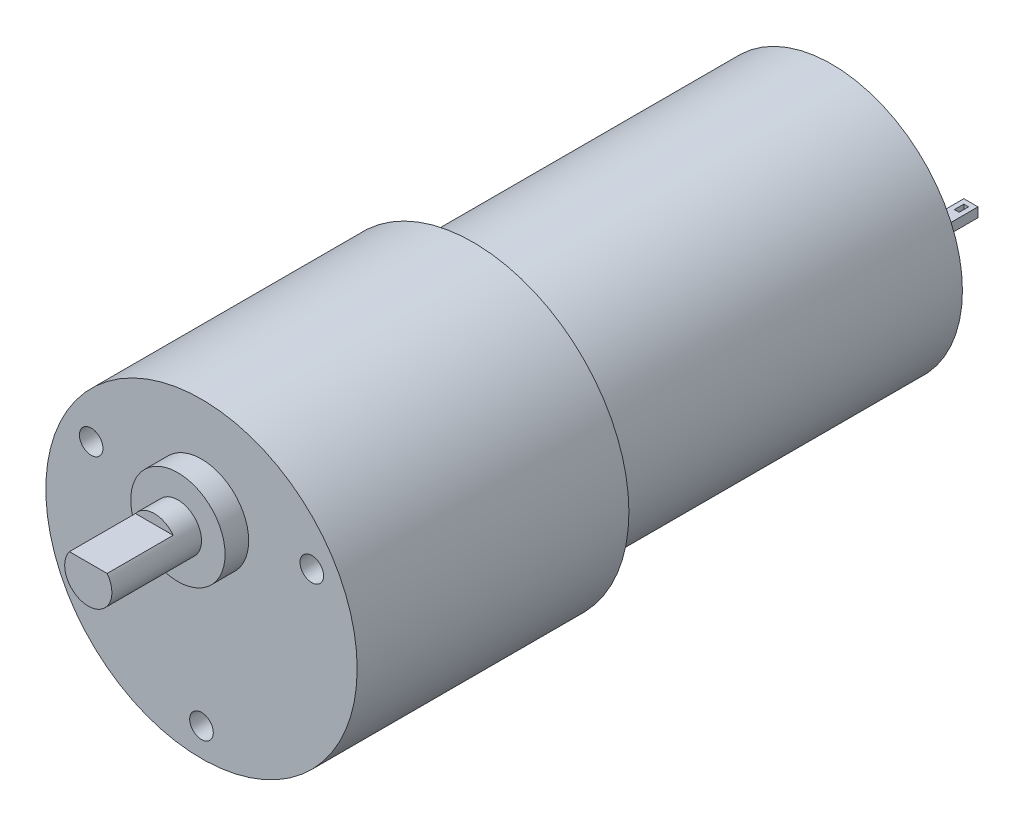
SolidWorks part; units mm, degrees
ref_plane "Plan de face" through (0, 0, 0) normal (0, 0, 1) x (1, 0, 0)
ref_plane "Plan de dessus" through (0, 0, 0) normal (0, 1, 0) x (1, 0, 0)
ref_plane "Plan de droite" through (0, 0, 0) normal (1, 0, 0) x (0, 0, -1)
sketch "Esquisse1" plane through (0, 0, 0) normal (0, 0, 1) x (1, 0, 0)
  circle A0 centre (0, 0) radius 13.85
  dimension "D1" = 27.7
extrude "Boss.-Extru.1" add sketch "Esquisse1" along normal blind 38
sketch "Esquisse2" plane through (0, 0, 0) normal (0, 0, -1) x (-1, 0, 0)
  circle A0 centre (0, 0) radius 5
  dimension "D1" = 10
extrude "Boss.-Extru.2" add sketch "Esquisse2" along normal blind 2.8
sketch "Esquisse3" plane through (0, 0, 0) normal (0, 1, 0) x (1, 0, 0)
  line L0 (13.85, 0) -> (-13.85, 0) construction
  line L1 (-7.5, 0) -> (-6, 0)
  line L2 (-7.5, 0) -> (-7.5, 8)
  line L3 (-7.5, 8) -> (-6, 8)
  line L4 (-6, 0) -> (-6, 8)
  line L5 (0, 0) -> (0, 2.8) construction
  line L6 (5, 2.8) -> (-5, 2.8) construction
  line L7 (6, 0) -> (6, 8)
  line L8 (7.5, 8) -> (6, 8)
  line L9 (7.5, 0) -> (7.5, 8)
  line L10 (7.5, 0) -> (6, 0)
  line L11 (6.5, 7.5) -> (6.5, 6.5)
  line L12 (-7, 7.5) -> (-6.5, 7.5)
  line L13 (-7, 7.5) -> (-7, 6.5)
  line L14 (-7, 6.5) -> (-6.5, 6.5)
  line L15 (-6.5, 7.5) -> (-6.5, 6.5)
  line L16 (7, 6.5) -> (6.5, 6.5)
  line L17 (7, 7.5) -> (7, 6.5)
  line L18 (7, 7.5) -> (6.5, 7.5)
  line L19 (-6.75, 7.5) -> (-6.75, 8) construction
  dimension "D1" = 12
  dimension "D2" = 1.5
  dimension "D3" = 8
  dimension "D4" = 0.5
  dimension "D5" = 1
  dimension "D6" = 0.5
extrude "Boss.-Extru.3" add sketch "Esquisse3" along normal mid plane 1
sketch "Esquisse4" plane through (0, 0, 38) normal (0, 0, 1) x (1, 0, 0)
  circle A0 centre (0, 0) radius 16.5
  dimension "D1" = 33
extrude "Boss.-Extru.4" add sketch "Esquisse4" along normal blind 28.8
hole_wizard "Trou taraudé M31" positions "Esquisse3D1" profile "Esquisse5" tap size "M3" standard "ISO"
sketch3d "Esquisse3D1"
  line L2 (0, 0, 0) -> (0, 0, 66.8) construction
  line L4 (0, 0, 66.8) -> (0, -13.5, 66.8) construction
  line L6 (0, 0, 66.8) -> (-11.6913, 6.75, 66.8) construction
  line L8 (11.6913, 6.75, 66.8) -> (0, 0, 66.8) construction
  circle A1 centre (0, 0, 66.8) radius 13.5 construction
  point P0 (0, -13.5, 66.8)
  point P2 (-11.6913, 6.75, 66.8)
  point P4 (11.6913, 6.75, 66.8)
  point P25 (0, 0, 80.3)
  dimension "D1" = 27
  dimension "D2" = 120
  dimension "D3" = 120
sketch "Esquisse5" plane through (0, -13.5, 66.8) normal (1, 0, 0) x (0, -1, 0)
  line L0 (0, 0) -> (0, 8.5)
  line L1 (0, 8.5) -> (1.25, 7.7489)
  line L2 (1.25, 7.7489) -> (1.25, 0)
  line L5 (1.25, 0) -> (0, 0)
  line L10 (0, 8.5) -> (-1.25, 7.7489) construction
  line L11 (0, -6.35) -> (0, 107.95) construction
  dimension "Diamètre du trou pour taraudage" = 2.5
  dimension "Profondeur du trou pour taraudage" = 8.5
  dimension "Angle de pointe" = 118
sketch "Esquisse6" plane through (0, 0, 66.8) normal (0, 0, 1) x (1, 0, 0)
  line L0 (0, 0) -> (0, 6) construction
  circle A0 centre (0, 6) radius 5
  dimension "D1" = 10
  dimension "D2" = 6
extrude "Boss.-Extru.5" add sketch "Esquisse6" along normal blind 2.5
sketch "Esquisse7" plane through (0, 0, 69.3) normal (0, 0, 1) x (1, 0, 0)
  circle A0 centre (0, 6) radius 2.5
  circle A1 centre (0, 6) radius 5 construction
  dimension "D1" = 5
extrude "Boss.-Extru.6" add sketch "Esquisse7" along normal blind 9.5
sketch "Esquisse8" plane through (0, 0, 78.8) normal (0, 0, 1) x (1, 0, 0)
  line L0 (0, 3.5) -> (0, 8.5) construction
  line L1 (-2, 7.5) -> (2, 7.5)
  circle A0 centre (0, 6) radius 2.5 construction
  circle A1 centre (0, 6) radius 2.5 construction
  arc A2 (-2, 7.5) -> (2, 7.5) centre (0, 6) cw
  dimension "D1" = 4
extrude "Enlèv. mat.-Extru.1" cut sketch "Esquisse8" against normal blind 7
